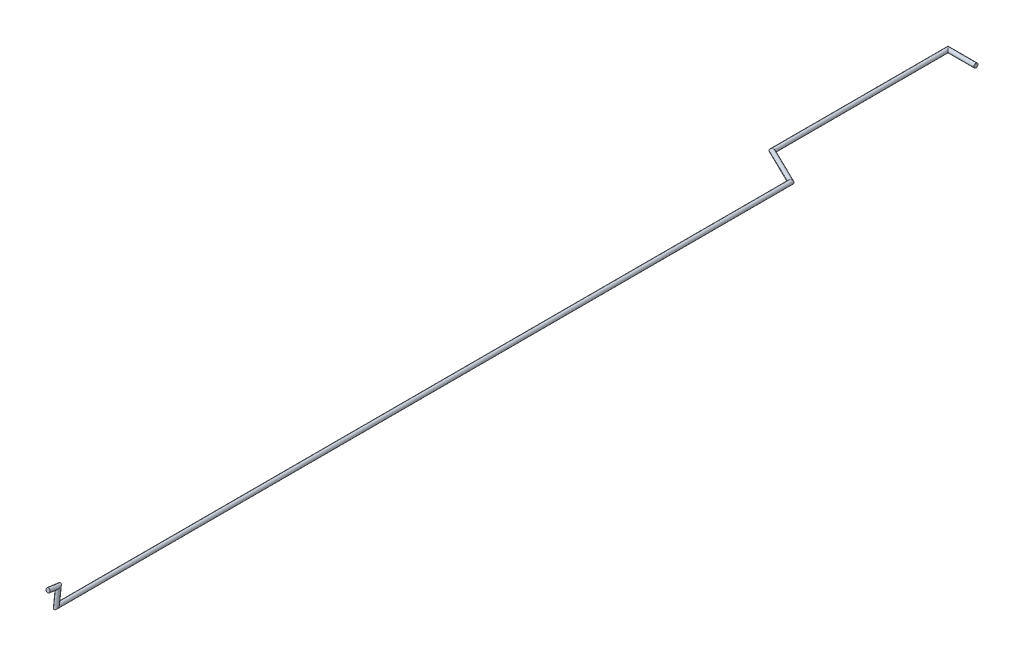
SolidWorks part; units mm, degrees
ref_plane "Plan de face" through (0, 0, 0) normal (0, 0, 1) x (1, 0, 0)
ref_plane "Plan de dessus" through (0, 0, 0) normal (0, 1, 0) x (1, 0, 0)
ref_plane "Plan de droite" through (0, 0, 0) normal (1, 0, 0) x (0, 0, -1)
sketch "Esquisse1" plane through (0, 0, 0) normal (1, 0, 0) x (0, 0, -1)
  line L0 (9.072, 0) -> (-17.3378, 0) construction
  line L1 (0, 7.581) -> (0, -2.4798) construction
  circle A0 centre (0, 0) radius 0.6
ref_plane "Plan1" through (0, 0, 0) normal (0, 1, 0) x (-1, 0, 0)
sketch3d "Esquisse3D1"
  line L0 (0, 0, 0) -> (-8.1, 0, 0)
  line L1 (-8.1, 0, 0) -> (-8.1, 0, 51)
  line L2 (-8.1, 0, 51) -> (2.4, 0, 56.1212)
  line L3 (2.4, 0, 56.1212) -> (2.4, 0, 269.1712)
  line L4 (2.4, 0, 269.1712) -> (2.4, 4.7419, 268.6401)
  line L7 (2.4, 4.7419, 268.6401) -> (2.4, 5.152, 271.612)
  dimension "D1" = 10.5
  dimension "D2" = 116
  dimension "D3" = 83.61
sweep "Balayage1" add profiles "Esquisse1" path "Esquisse3D1"
